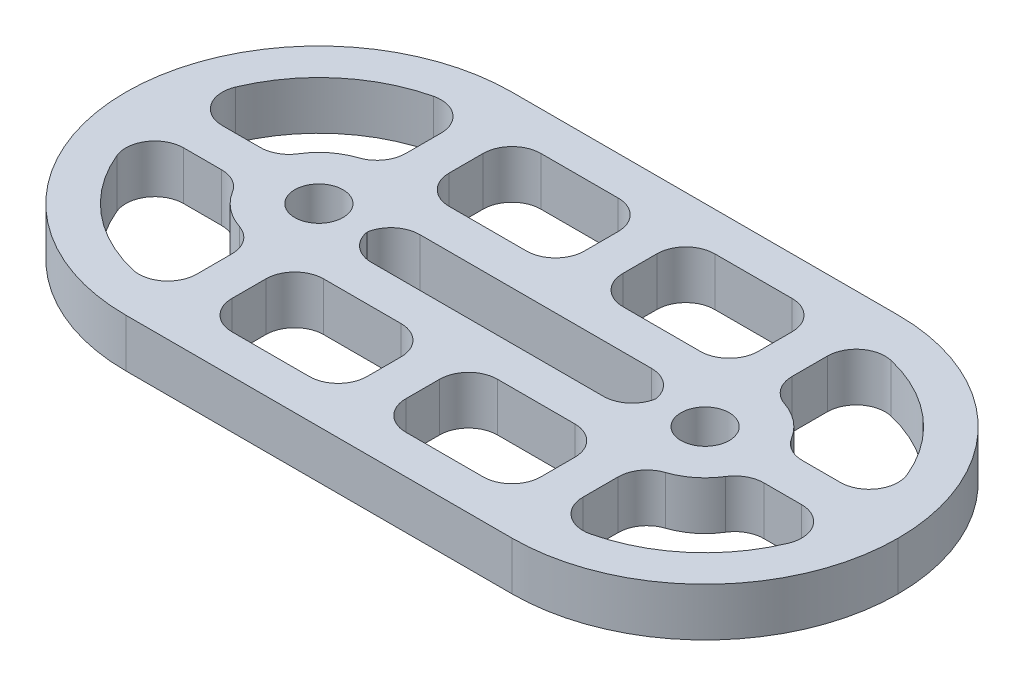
SolidWorks part; units mm, degrees
ref_plane "Front Plane" through (0, 0, 0) normal (0, 0, 1) x (1, 0, 0)
ref_plane "Top Plane" through (0, 0, 0) normal (0, 1, 0) x (1, 0, 0)
ref_plane "Right Plane" through (0, 0, 0) normal (1, 0, 0) x (0, 0, -1)
sketch "Sketch1" plane through (0, 0, 0) normal (0, 1, 0) x (1, 0, 0)
  line L1 (0, 0) -> (50.8, 0)
  line L2 (0, 0) -> (0, 25.4)
  line L3 (0, 25.4) -> (50.8, 25.4)
  line L4 (50.8, 0) -> (50.8, 25.4)
  dimension "D1" = 25.4
  dimension "D2" = 50.8
extrude "Boss-Extrude1" add sketch "Sketch1" along normal blind 3.175
fillet "Fillet1" radius 12.7 4 edges at (0, 1.5875, 0) (0, 1.5875, -25.4) (50.8, 1.5875, -25.4) (50.8, 1.5875, 0)
sketch "Sketch2" plane through (0, 3.175, 0) normal (0, 1, 0) x (1, 0, 0)
  circle A0 centre (12.7, 12.7) radius 1.5875
  circle A1 centre (38.1, 12.7) radius 1.5875
  arc A2 (0, 12.7) -> (12.7, 0) centre (12.7, 12.7) ccw construction
  arc A4 (38.1, 0) -> (50.8, 12.7) centre (38.1, 12.7) ccw construction
  dimension "D1" = 3.175
  dimension "D2" = 3.175
  dimension "D3" = 0
  dimension "D4" = 25.4
  dimension "D5" = 0
extrude "Cut-Extrude1" cut sketch "Sketch2" against normal blind 3.175
sketch "Sketch3" plane through (0, 0, 0) normal (0, -1, 0) x (1, 0, 0)
  line L0 (12.7, -8.5725) -> (38.1, -8.5725)
  line L1 (12.7, -16.8275) -> (38.1, -16.8275)
  line L2 (12.7, -2.54) -> (38.1, -2.54)
  line L3 (12.7, -22.86) -> (38.1, -22.86)
  circle A0 centre (12.7, -12.7) radius 10.16
  circle A1 centre (38.1, -12.7) radius 10.16
  arc A2 (12.7, 0) -> (0, -12.7) centre (12.7, -12.7) ccw construction
  arc A3 (50.8, -12.7) -> (38.1, 0) centre (38.1, -12.7) ccw construction
  circle A4 centre (12.7, -12.7) radius 4.1275
  circle A5 centre (38.1, -12.7) radius 4.1275
  circle A6 centre (12.7, -12.7) radius 1.5875 construction
  circle A7 centre (38.1, -12.7) radius 1.5875 construction
  dimension "D1" = 2.54
  dimension "D2" = 2.54
  dimension "D3" = 2.54
  dimension "D4" = 2.54
  dimension "D6" = 25.4
  dimension "D5" = 25.4
  dimension "D7" = 0
  dimension "D8" = 25.4
  dimension "D9" = 0
  dimension "D10" = 25.4
  dimension "D11" = 0
extrude "Cut-Extrude2" cut sketch "Sketch3" against normal blind 3.175 contours A4 L0 A0 L1 | A1 L2 A0 L0 | A5 L1 A1 L0 | A1 L1 A0 L3
sketch "Sketch4" plane through (0, 0, 0) normal (0, -1, 0) x (1, 0, 0)
  line L0 (12.7, -2.54) -> (38.1, -2.54) construction
  line L1 (26.67, -2.54) -> (24.13, -2.54)
  line L2 (26.67, -2.54) -> (26.67, -8.5725)
  line L3 (26.67, -8.5725) -> (24.13, -8.5725)
  line L4 (24.13, -2.54) -> (24.13, -8.5725)
  line L5 (12.7, -8.5725) -> (38.1, -8.5725) construction
  line L7 (12.7, -8.5725) -> (15.24, -8.5725)
  line L8 (12.7, -8.5725) -> (12.7, -2.54)
  line L9 (12.7, -2.54) -> (15.24, -2.54)
  line L10 (15.24, -8.5725) -> (15.24, -2.54)
  line L11 (2.54, -11.43) -> (9.525, -11.43)
  line L12 (2.54, -11.43) -> (2.54, -13.97)
  line L13 (2.54, -13.97) -> (9.525, -13.97)
  line L14 (9.525, -11.43) -> (9.525, -13.97)
  circle A0 centre (12.7, -12.7) radius 1.5875 construction
  circle A1 centre (38.1, -12.7) radius 1.5875 construction
  dimension "D1" = 13.97
  dimension "D2" = 13.97
  dimension "D3" = 2.54
  dimension "D4" = 0
  dimension "D5" = 0
  dimension "D6" = 2.54
  dimension "D7" = 1.27
  dimension "D8" = 3.175
  dimension "D9" = 10.16
extrude "Boss-Extrude2" add sketch "Sketch4" against normal blind 3.175
ref_plane "Plane1" through (25.4, 0, 0) normal (1, 0, 0) x (0, 0, -1)
mirror "Mirror1" about plane through (25.4, 0, 0) normal (1, 0, 0) of "Boss-Extrude2"
ref_plane "Plane2" through (0, 0, -12.7) normal (0, 0, 1) x (1, 0, 0)
mirror "Mirror2" about plane through (0, 0, -12.7) normal (0, 0, 1) of "Mirror1", "Boss-Extrude2"
sketch "Sketch5" plane through (0, 0, 0) normal (0, -1, 0) x (1, 0, 0)
  line L1 (15.875, -11.0808) -> (34.925, -11.0808)
  line L2 (15.875, -11.0808) -> (15.875, -14.2557)
  line L3 (15.875, -14.2557) -> (34.925, -14.2557)
  line L4 (34.925, -11.0808) -> (34.925, -14.2557)
  circle A0 centre (12.7, -12.7) radius 1.5875 construction
  circle A1 centre (38.1, -12.7) radius 1.5875 construction
  dimension "D1" = 3.175
  dimension "D2" = 1.5557
  dimension "D3" = 3.175
  dimension "D4" = 3.175
extrude "Cut-Extrude3" cut sketch "Sketch5" against normal blind 3.175
fillet "Fillet2" radius 1.905 36 edges at (2.6197, 1.5875, -11.43) (8.7727, 1.5875, -11.43) (12.7, 1.5875, -8.5725) (12.7, 1.5875, -2.54) (15.24, 1.5875, -8.5725) (15.24, 1.5875, -2.54) (24.13, 1.5875, -2.54) (24.13, 1.5875, -8.5725) (48.1803, 1.5875, -11.43) (42.0273, 1.5875, -11.43) (38.1, 1.5875, -8.5725) (38.1, 1.5875, -2.54) (35.56, 1.5875, -2.54) (35.56, 1.5875, -8.5725) (26.67, 1.5875, -8.5725) (26.67, 1.5875, -2.54) (35.56, 1.5875, -22.86) (24.13, 1.5875, -22.86) (48.1803, 1.5875, -13.97) (35.56, 1.5875, -16.8275) (24.13, 1.5875, -16.8275) (42.0273, 1.5875, -13.97) (38.1, 1.5875, -16.8275) (26.67, 1.5875, -16.8275) (38.1, 1.5875, -22.86) (26.67, 1.5875, -22.86) (15.24, 1.5875, -22.86) (15.24, 1.5875, -16.8275) (12.7, 1.5875, -16.8275) (12.7, 1.5875, -22.86) (8.7727, 1.5875, -13.97) (2.6197, 1.5875, -13.97) (15.875, 1.5875, -14.2557) (34.925, 1.5875, -14.2557) (34.925, 1.5875, -11.0808) (15.875, 1.5875, -11.0808)
